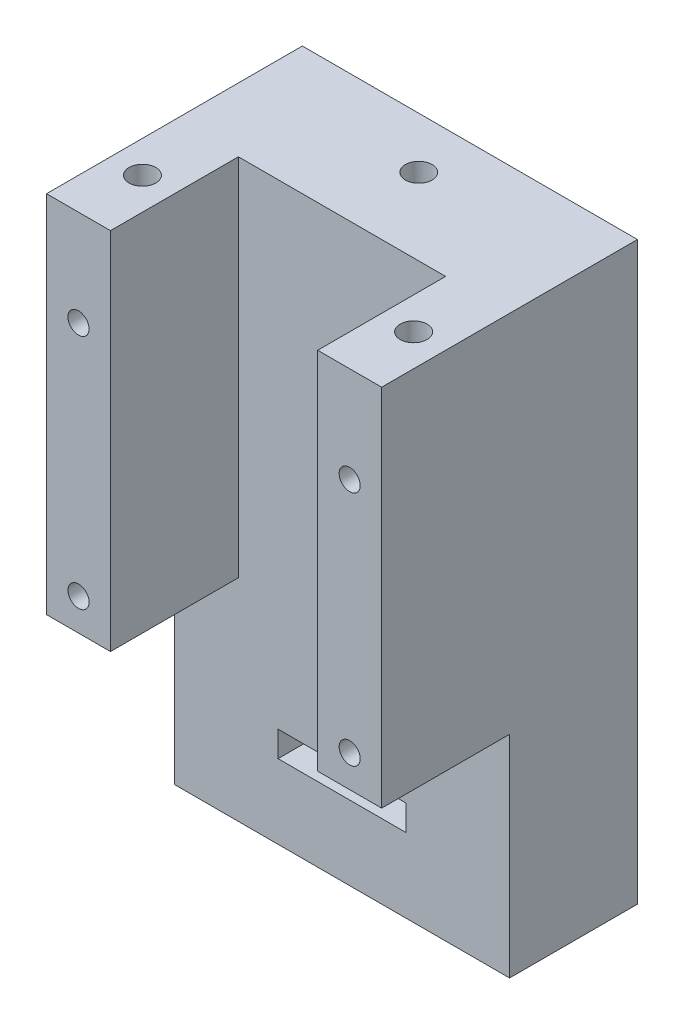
SolidWorks part; units mm, degrees
ref_plane "前视基准面" through (0, 0, 0) normal (0, 0, 1) x (1, 0, 0)
ref_plane "上视基准面" through (0, 0, 0) normal (0, 1, 0) x (1, 0, 0)
ref_plane "右视基准面" through (0, 0, 0) normal (1, 0, 0) x (0, 0, -1)
sketch "草图1" plane through (0, 0, 0) normal (0, 0, 1) x (1, 0, 0)
  line L0 (52.4, 0) -> (52.4, 90)
  line L1 (0, 0) -> (0, 90)
  line L2 (0, 0) -> (52.4, 0)
  line L3 (0, 90) -> (52.4, 90)
  line L4 (16.2, 11.6) -> (16.2, 15.6)
  line L5 (36.2, 15.6) -> (36.2, 11.6)
  line L6 (16.2, 15.6) -> (36.2, 15.6)
  line L7 (16.2, 11.6) -> (36.2, 11.6)
extrude "凸台-拉伸1" add sketch "草图1" along normal blind 40
sketch "草图2" plane through (52.4, 0, 0) normal (1, 0, 0) x (0, 0, -1)
  line L0 (-40, 90) -> (0, 90)
  line L1 (-20, 0) -> (0, 0)
  line L2 (-40, 33) -> (-20, 33)
  line L3 (-20, 0) -> (-20, 33)
  line L4 (0, 0) -> (0, 90)
  line L5 (-40, 33) -> (-40, 90)
extrude "切除-拉伸1" cut sketch "草图2" against normal through all flip side to cut
sketch "草图3" plane through (0, 0, 40) normal (0, 0, 1) x (1, 0, 0)
  circle A0 centre (5, 75) radius 1.65
  circle A1 centre (47.4, 75) radius 1.65
  circle A2 centre (47.4, 38) radius 1.65
  circle A3 centre (5, 38) radius 1.65
extrude "切除-拉伸2" cut sketch "草图3" against normal blind 15
sketch "草图4" plane through (0, 90, 0) normal (0, 1, 0) x (1, 0, 0)
  line L0 (10, -40) -> (10, -20)
  line L1 (42.4, -40) -> (42.4, -20)
  line L2 (52.4, -40) -> (52.4, 0)
  line L3 (0, -40) -> (0, 0)
  line L4 (10, -20) -> (42.4, -20)
  line L5 (0, 0) -> (52.4, 0)
  line L6 (0, -40) -> (10, -40)
  line L7 (42.4, -40) -> (52.4, -40)
extrude "切除-拉伸3" cut sketch "草图4" against normal through all flip side to cut
sketch "草图5" plane through (0, 90, 0) normal (0, 1, 0) x (1, 0, 0)
  circle A0 centre (26.2, -8) radius 2.1
  circle A1 centre (5, -30) radius 2.1
  circle A2 centre (47.4, -30) radius 2.1
extrude "切除-拉伸4" cut sketch "草图5" against normal blind 15
sketch "草图6" plane through (0, 90, 0) normal (0, 1, 0) x (1, 0, 0)
  circle A0 centre (8, -10) radius 2.5 construction
  circle A1 centre (44.4, -10) radius 2.5 construction
sketch "草图7" plane through (0, 0, 0) normal (0, -1, 0) x (1, 0, 0)
  circle A0 centre (8, 10) radius 2.5
  circle A1 centre (44.4, 10) radius 2.5
extrude "切除-拉伸5" cut sketch "草图7" against normal blind 15
